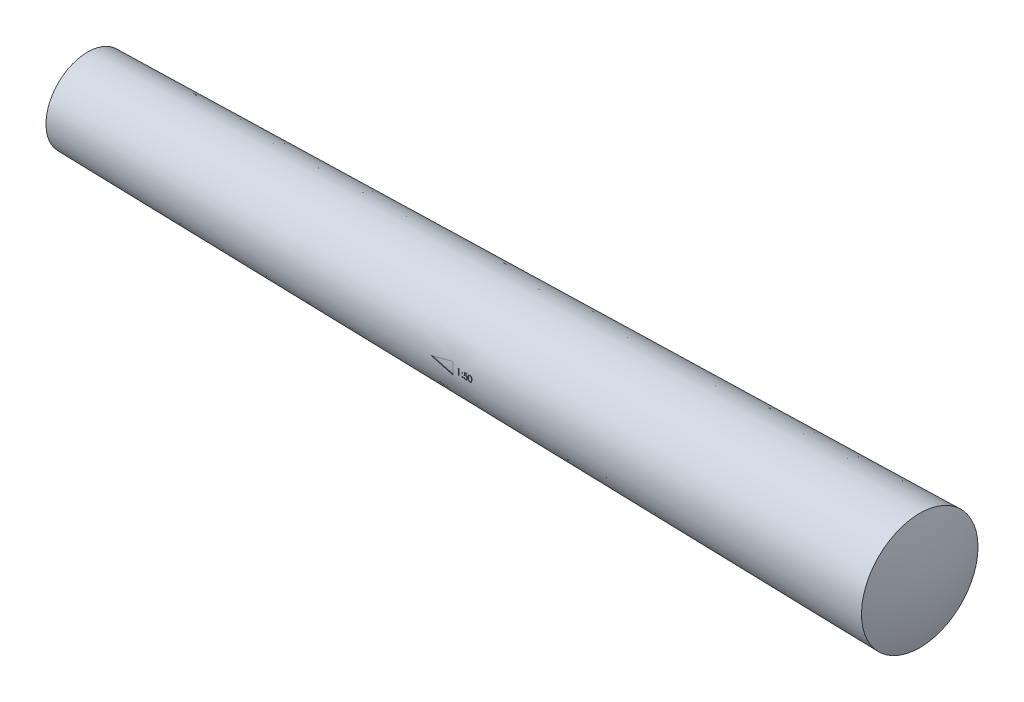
SolidWorks part; units mm, degrees
ref_plane "Front Plane" through (0, 0, 0) normal (0, 0, 1) x (1, 0, 0)
ref_plane "Top Plane" through (0, 0, 0) normal (0, 1, 0) x (1, 0, 0)
ref_plane "Right Plane" through (0, 0, 0) normal (1, 0, 0) x (0, 0, -1)
sketch "Sketch1" plane through (0, 0, 0) normal (1, 0, 0) x (0, 0, -1)
  circle A0 centre (0, 0) radius 7
  dimension "D1" = 14
extrude "Extrude1" add sketch "Sketch1" along normal mid plane 140
draft "Draft1" type of draft neutral plane draft angle 1.146 faces to draft 1 parameters "D1"=1.146
sketch "Sketch2" plane through (0, 0, 0) normal (0, 0, 1) x (1, 0, 0)
  line L0 (-70, 0) -> (-70, 7)
  line L1 (-70, 7) -> (-70, -7) construction
  line L2 (-70, 0) -> (-71.6, 0)
  line L3 (-71.6, 0) -> (-71.6, -8.4) construction
  line L4 (70, 0) -> (70, 9.8001)
  line L5 (70, -9.8001) -> (70, 9.8001) construction
  line L6 (70, 0) -> (71.6, 0)
  line L7 (71.6, 0) -> (71.6, -8.4) construction
  line L8 (-70, -7) -> (70, -9.8001) construction
  arc A0 (-71.6, 0) -> (-70, 7) centre (-55.4875, 0) cw
  arc A1 (71.6, 0) -> (70, 9.8001) centre (40.7869, 0) ccw
  point P14 (0, -8.4)
revolve "Revolve1" add sketch "Sketch2" angle 360 about L2
sketch "Sketch5" plane through (0, 0, 0) normal (0, 0, 1) x (1, 0, 0)
  line L0 (0, 8.4) -> (0, -8.4) construction
  line L1 (70, 9.8001) -> (-70, 7) construction
  line L2 (-70, -7) -> (70, -9.8001) construction
ref_plane "Plane2" through (0, 0, 0) normal (-0.02, 0, 0.9998) x (0.9998, 0, 0.02)
sketch "Sketch6" plane through (0, 0, 0) normal (-0.02, 0, 0.9998) x (0.9998, 0, 0.02)
  line L0 (0, 0) -> (0, 1)
  line L1 (0, 8.4) -> (0, -8.4) construction
  line L2 (0, 1) -> (-3.7321, 0)
  line L3 (-3.7321, 0) -> (0, -1)
  line L4 (0, -1) -> (0, 0)
  line L5 (0, -0.5) -> (4, -0.5) construction
  text T0 "1:50" font "Century Gothic" height 1
  dimension "D1" = 2
  dimension "D2" = 30
  dimension "D3" = 4
wrap "Wrap2" sketch "Sketch6" wrap type deboss source sketch "Sketch6" thickness 0.1 parameters "D1"=0.1
equation "\"D2@Sketch2\" = \"D1@Sketch2\""
